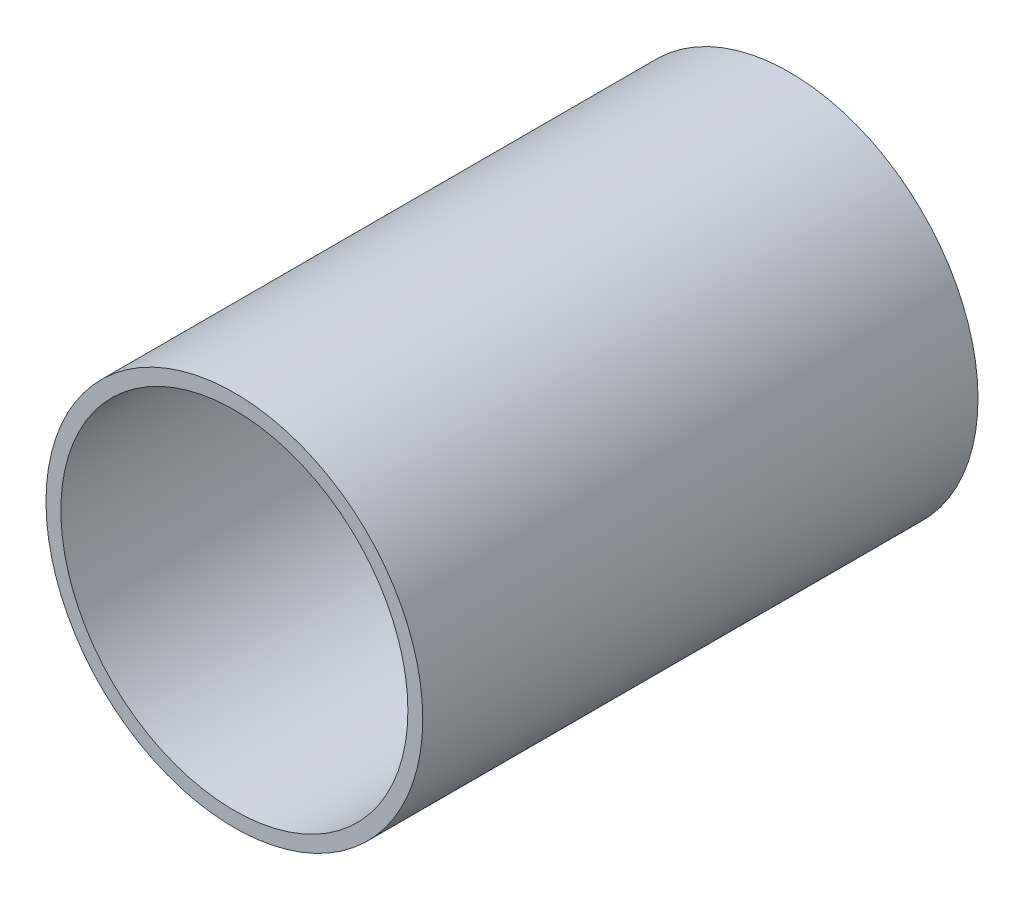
SolidWorks part; units mm, degrees
ref_plane "Front Plane" through (0, 0, 0) normal (0, 0, 1) x (1, 0, 0)
ref_plane "Top Plane" through (0, 0, 0) normal (0, 1, 0) x (1, 0, 0)
ref_plane "Right Plane" through (0, 0, 0) normal (1, 0, 0) x (0, 0, -1)
sketch "Sketch1" plane through (0, 0, 0) normal (0, 0, 1) x (1, 0, 0)
  circle A0 centre (0, 0) radius 111.125
  circle A1 centre (0, 0) radius 120.65
  dimension "D1" = 241.3
  dimension "D2" = 9.525
extrude "Boss-Extrude1" add sketch "Sketch1" against normal blind 355.6 contours A0
